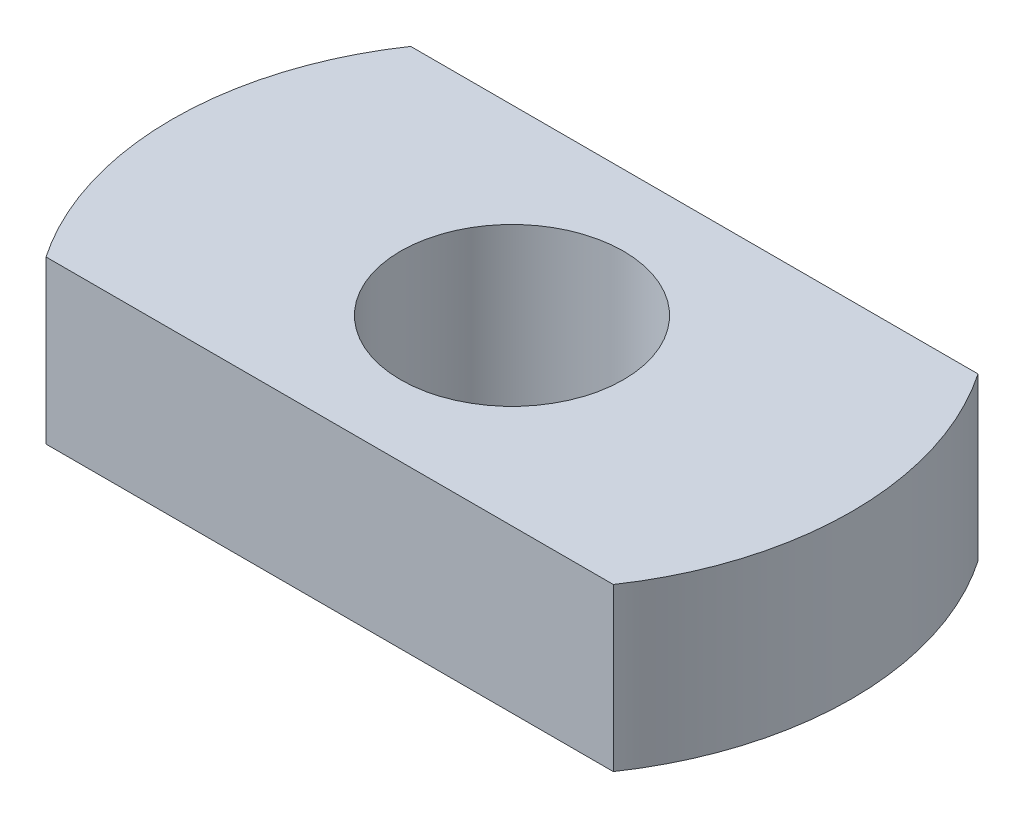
SolidWorks part; units mm, degrees
ref_plane "前视基准面" through (0, 0, 0) normal (0, 0, 1) x (1, 0, 0)
ref_plane "上视基准面" through (0, 0, 0) normal (0, 1, 0) x (1, 0, 0)
ref_plane "右视基准面" through (0, 0, 0) normal (1, 0, 0) x (0, 0, -1)
sketch "Sketch1" plane through (0, 0, 0) normal (0, 1, 0) x (1, 0, 0)
  line L0 (-103.5707, 0) -> (101.1621, 0) construction
  line L1 (0, 72.2586) -> (0, -80.2874) construction
  line L3 (-70, 45) -> (70, 45)
  line L5 (-70, -45) -> (70, -45)
  arc A0 (-70, 45) -> (-70, -45) centre (-3.8562, 0) ccw
  arc A1 (70, 45) -> (70, -45) centre (3.8562, 0) cw
  circle A2 centre (0, 0) radius 27.5
  dimension "D3" = 80
  dimension "D4" = 80
  dimension "D5" = 55
  dimension "D1" = 140
  dimension "D2" = 90
extrude "Extrude1" add sketch "Sketch1" along normal blind 40
